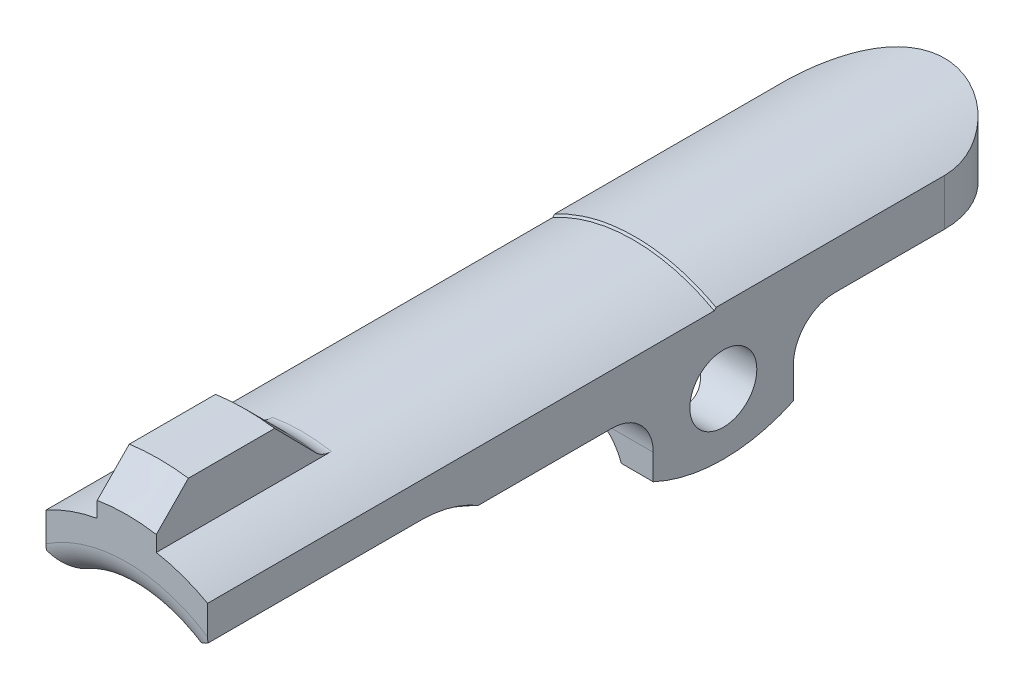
SolidWorks part; units mm, degrees
ref_plane "Front Plane" through (0, 0, 0) normal (0, 0, 1) x (1, 0, 0)
ref_plane "Top Plane" through (0, 0, 0) normal (0, 1, 0) x (1, 0, 0)
ref_plane "Right Plane" through (0, 0, 0) normal (1, 0, 0) x (0, 0, -1)
sketch "Sketch1" plane through (0, 0, 0) normal (0, 0, 1) x (1, 0, 0)
  line L1 (-3.1, 0) -> (3.1, 0)
  line L2 (-3.1, 0) -> (-3.1, 1.94)
  line L4 (3.1, 0) -> (3.1, 1.94)
  arc A0 (3.1, 1.94) -> (-3.1, 1.94) centre (0, -3.6019) ccw
  dimension "D3" = 6.35
  dimension "D1" = 6.2
  dimension "D2" = 1.94
extrude "Boss-Extrude1" add sketch "Sketch1" against normal blind 19.52
sketch "Sketch2" plane through (0, 0, -19.52) normal (0, 0, -1) x (-1, 0, 0)
  line L0 (-3.1, 0) -> (-3.1, 1.94) construction
  line L1 (-3.1, 0.23) -> (3.1, 0.23)
  line L2 (-3.1, 0.23) -> (-3.1, 2.02)
  line L4 (3.1, 0.23) -> (3.1, 2.02)
  line L5 (3.1, 1.94) -> (3.1, 0) construction
  arc A0 (-3.1, 2.02) -> (3.1, 2.02) centre (0, -3.6134) cw
  dimension "D3" = 6.43
  dimension "D1" = 0.23
  dimension "D2" = 1.79
extrude "Boss-Extrude2" add sketch "Sketch2" along normal blind 11.86
sketch "Sketch3" plane through (0, 0.23, 0) normal (0, -1, 0) x (1, 0, 0)
  line L0 (-3.1, -31.38) -> (-3.1, -19.52) construction
  line L1 (3.1, -31.38) -> (3.1, -19.52) construction
  line L2 (-3.1, -28.28) -> (3.1, -28.28)
  line L3 (3.1, -31.38) -> (-3.1, -31.38) construction
  line L4 (-3.1, -28.28) -> (-3.1, -31.38)
  line L5 (-3.1, -31.38) -> (3.1, -31.38)
  line L6 (3.1, -31.38) -> (3.1, -28.28)
  arc A0 (-3.1, -28.28) -> (3.1, -28.28) centre (0, -28.28) ccw
extrude "Cut-Extrude1" cut sketch "Sketch3" against normal up to next contours A0 M2 M3 | A0 L5 M4
sketch "Sketch4" plane through (0, 0.23, 0) normal (0, -1, 0) x (1, 0, 0)
  line L0 (-3.1, -28.28) -> (-3.1, -19.52) construction
  line L1 (-3.1, -22.48) -> (3.1, -22.48)
  line L2 (-3.1, -22.48) -> (-3.1, -17.1)
  line L3 (-3.1, -17.1) -> (3.1, -17.1)
  line L4 (3.1, -22.48) -> (3.1, -17.1)
  line L5 (3.1, -19.52) -> (3.1, 0) construction
  arc A0 (-3.1, -28.28) -> (3.1, -28.28) centre (0, -28.28) ccw construction
  point P8 (0, -31.38)
  dimension "D1" = 5.38
  dimension "D2" = 8.9
extrude "Boss-Extrude3" add sketch "Sketch4" along normal blind 3.4
fillet "Fillet1" radius 1.59 2 edges at (0, 0, -17.1) (0, 0.23, -22.48)
sketch "Sketch5" plane through (0, 0, 0) normal (0, 0, -1) x (-1, 0, 0)
  line L0 (0, 0) -> (0, -3.21) construction
  line L1 (-3.1, 0.23) -> (3.1, 0.23) construction
  circle A0 centre (0, -3.21) radius 1.98
  dimension "D1" = 3.96
  dimension "D2" = 3.44
extrude "Cut-Extrude2" cut sketch "Sketch5" along normal up to next
sketch "Sketch6" plane through (3.1, 0, 0) normal (1, 0, 0) x (0, 0, -1)
  line L0 (19.79, 3.18) -> (19.79, -3.17) construction
  line L1 (22.48, -3.17) -> (17.1, -3.17) construction
  line L2 (28.28, 0.23) -> (24.07, 0.23) construction
  line L3 (17.1, -2.5721) -> (17.1, -4.7748)
  line L4 (22.48, -2.5721) -> (22.48, -4.7748)
  line L5 (22.48, -3.17) -> (22.48, -1.36) construction
  line L6 (22.48, -4.7748) -> (17.1, -4.7748)
  line L7 (17.1, -3.17) -> (17.1, -1.59) construction
  circle A0 centre (19.79, 3.18) radius 6.35
  dimension "D1" = 12.7
  dimension "D2" = 2.95
extrude "Cut-Extrude3" cut sketch "Sketch6" against normal through all contours A0 M3 M4 | A0 M4 M5
sketch "Sketch7" plane through (-3.1, 0, 0) normal (-1, 0, 0) x (0, 0, 1)
  line L0 (-28.28, 0.23) -> (-24.07, 0.23) construction
  line L1 (-19.79, -0.82) -> (-19.79, -3.17) construction
  circle A0 centre (-19.79, -0.82) radius 1.285
  arc A1 (-22.48, -2.5721) -> (-17.1, -2.5721) centre (-19.79, 3.18) ccw construction
  dimension "D1" = 2.57
  dimension "D2" = 1.05
extrude "Cut-Extrude4" cut sketch "Sketch7" against normal through all
sketch "Sketch8" plane through (0, 0, 0) normal (0, 0, 1) x (1, 0, 0)
  line L0 (0, 1) -> (0, 0) construction
  line L2 (-1.1337, 4.4992) -> (-1.1337, 1)
  line L3 (-1.1337, 1) -> (1.1337, 1)
  line L4 (1.1337, 4.4992) -> (1.1337, 1)
  circle A1 centre (0, -3.6019) radius 8.18
  dimension "D2" = 16.36
  dimension "D1" = 1
extrude "Boss-Extrude4" add sketch "Sketch8" against normal blind 6.44 contours L4 A1 L2 M4
chamfer "Chamfer1" distance 1.23 distance2 1.24 1 edges at (0, 4.5781, 0)
chamfer "Chamfer2" distance 1.9 distance2 1.9 1 edges at (0, 4.5781, -6.44)
fillet "Fillet2" radius 0.84 1 edges at (0, 2.7481, -6.37)
chamfer "Chamfer3" distance 0.08 angle 45 1 edges
ref_plane "Plane1" through (0, 0, -1.5) normal (0, 0, 1) x (1, 0, 0)
sketch "Sketch9" plane through (0, 0, -1.5) normal (0, 0, 1) x (1, 0, 0)
  line L0 (0, 0) -> (0, -4.93) construction
  circle A0 centre (0, -4.93) radius 6.35
  dimension "D1" = 12.7
  dimension "D2" = 4.93
extrude "Cut-Extrude5" cut sketch "Sketch9" against normal blind 1.57
sketch "Sketch10" plane through (0, 0, 0) normal (0, 0, 1) x (1, 0, 0)
  line L0 (0, 0) -> (0, -3.81) construction
  circle A0 centre (0, -3.81) radius 4.37
  dimension "D1" = 8.74
  dimension "D2" = 3.81
extrude "Cut-Extrude6" cut sketch "Sketch10" against normal up to next
sketch "Sketch11" plane through (0, 0, 0) normal (0, 0, 1) x (1, 0, 0)
  line L0 (-3.1, 0) -> (-3.1, 0.61)
  line L1 (-3.1, 1.94) -> (-3.1, 0) construction
  line L2 (-3.1, 0.61) -> (-2.14, 0)
  line L3 (-3.1, 0) -> (-2.1403, 0) construction
  line L4 (-2.14, 0) -> (-3.1, 0)
  line L5 (0, 2.2644) -> (0, -2.0445) construction
  line L6 (2.14, 0) -> (3.1, 0)
  line L7 (3.1, 0) -> (3.1, 0.61)
  line L8 (3.1, 0.61) -> (2.14, 0)
  dimension "D1" = 0.61
  dimension "D2" = 0.96
extrude "Cut-Extrude7" cut sketch "Sketch11" against normal blind 13.18
fillet "Fillet3" radius 5 2 edges at (2.62, 0.305, -13.18) (-2.62, 0.305, -13.18)
fillet "Fillet4" radius 1.2 1 edges at (0, 0.56, 0)
sketch "Sketch12" plane through (0, 0.23, 0) normal (0, -1, 0) x (1, 0, 0)
  line L0 (0, -28.5) -> (0, -31.38) construction
  circle A0 centre (0, -28.5) radius 2
  arc A1 (-3.1, -28.28) -> (3.1, -28.28) centre (0, -28.28) ccw construction
  dimension "D1" = 4
  dimension "D2" = 2.88
extrude "Cut-Extrude8" cut sketch "Sketch12" against normal blind 1.93
chamfer "Chamfer4" distance 0.76 angle 45 1 edges at (0, 0.23, -30.5)
